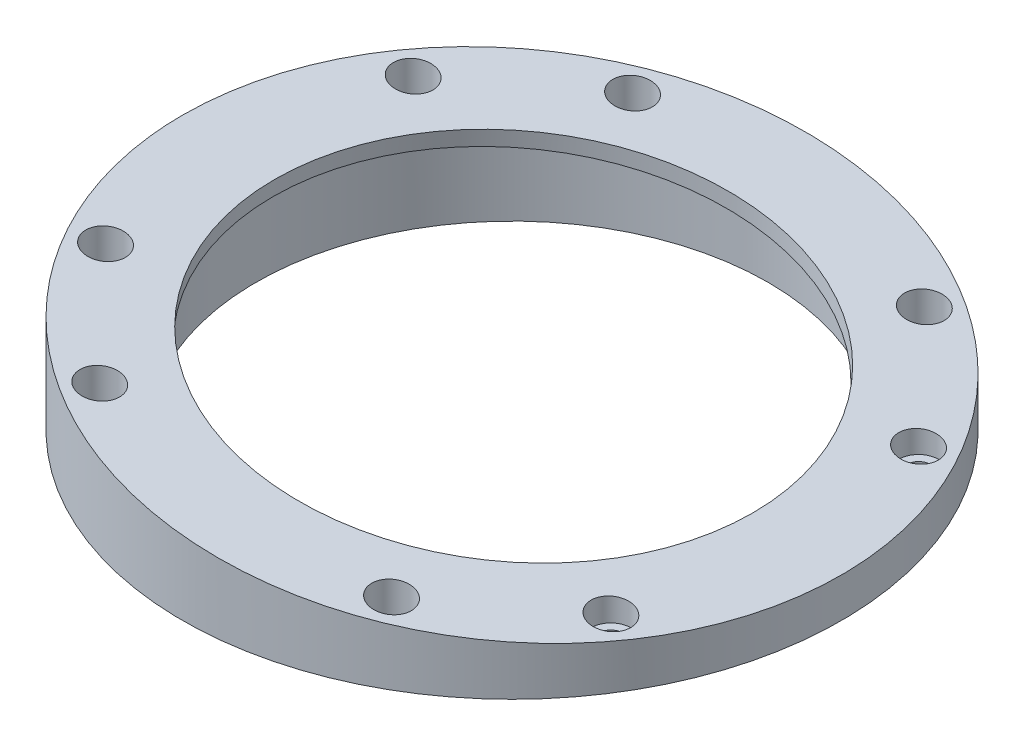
SolidWorks part; units mm, degrees
ref_plane "Front Plane" through (0, 0, 0) normal (0, 0, 1) x (1, 0, 0)
ref_plane "Top Plane" through (0, 0, 0) normal (0, 1, 0) x (1, 0, 0)
ref_plane "Right Plane" through (0, 0, 0) normal (1, 0, 0) x (0, 0, -1)
sketch "Sketch1" plane through (0, 0, 0) normal (0, 0, 1) x (1, 0, 0)
  line L13 (0, 0) -> (254, 0)
  line L14 (0, 0) -> (0, 254)
  line L15 (0, 254) -> (254, 254)
  line L16 (254, 0) -> (254, 254)
  dimension "D1" = 254
  dimension "D2" = 254
extrude "Boss-Extrude1" add sketch "Sketch1" along normal blind 254
sketch "Sketch5" plane through (0, 254, 0) normal (0, 1, 0) x (1, 0, 0)
  line L1 (0, 0) -> (254, 0)
  line L2 (0, 0) -> (0, -254)
  line L3 (0, -254) -> (254, -254)
  line L4 (254, 0) -> (254, -254)
  circle A0 centre (127, -127) radius 66.167
  dimension "D1" = 132.334
extrude "Cut-Extrude2" cut sketch "Sketch5" against normal through all
ref_plane "Plane1" through (0, 0, 193.167) normal (0, 0, 1) x (1, 0, 0)
sketch "Sketch6" plane through (0, 254, 0) normal (0, 1, 0) x (1, 0, 0)
  circle A1 centre (127, -127) radius 42.418
  dimension "D1" = 84.836
extrude "Cut-Extrude3" cut sketch "Sketch6" against normal through all
sketch "Sketch7" plane through (0, 0, 193.167) normal (0, 0, 1) x (1, 0, 0)
  line L0 (60.833, 254) -> (193.167, 240.2079)
  line L1 (193.167, 0) -> (193.167, 254) construction
  line L5 (193.167, 240.2079) -> (60.833, 240.2079)
  line L6 (60.833, 254) -> (60.833, 0) construction
  line L7 (60.833, 254) -> (193.167, 254)
  line L8 (193.167, 254) -> (193.167, 240.2079)
extrude "Cut-Extrude4" cut sketch "Sketch7" against normal up to next contours L8 L7 L0
sketch "Sketch8" plane through (0, 0, 0) normal (0, -1, 0) x (1, 0, 0)
  circle A0 centre (127, 127) radius 66.167
  circle A1 centre (127, 127) radius 50.8
  dimension "D1" = 101.6
extrude "Cut-Extrude5" cut sketch "Sketch8" against normal blind 232.283
sketch "Sketch11" plane through (0, 0, 0) normal (0, -1, 0) x (1, 0, 0)
  circle A0 centre (127, 127) radius 47.625
  circle A1 centre (127, 127) radius 50.8
extrude "Cut-Extrude6" cut sketch "Sketch11" against normal offset from surface (243.9117 mm away) 3.175
sketch "Sketch13" plane through (0, 0, 0) normal (0, -1, 0) x (1, 0, 0)
  circle A0 centre (127, 127) radius 47.8448
extrude "Cut-Extrude7" cut sketch "Sketch13" against normal up to surface (243.9117 mm away)
hole_wizard "1/16 (0.0625) Clearance Dowel Hole1" positions "Sketch14" profile "Sketch15" hole size "1/16" standard "ANSI Inch"
sketch "Sketch14" plane through (0, 232.283, 0) normal (0, -1, 0) x (-1, 0, 0)
  point P4 (-85.5349, -166.329)
sketch "Sketch15" plane through (85.5349, 232.283, 166.329) normal (1, 0, 0) x (0, 0, -1)
  line L0 (0, 0) -> (0, 6.8269)
  line L1 (0, 6.8269) -> (0.7937, 6.35)
  line L2 (0.7937, 6.35) -> (0.7937, 0)
  line L5 (0.7937, 0) -> (0, 0)
  line L10 (0, 6.8269) -> (-0.7938, 6.35) construction
  line L11 (0, -6.35) -> (0, 107.95) construction
  dimension "Hole Dia." = 1.5875
  dimension "Hole Depth" = 6.35
  dimension "Drill Angle" = 118
hole_wizard "1/16 (0.0625) Press Dowel Hole1" positions "Sketch16" profile "Sketch17" hole size "1/16" standard "ANSI Inch"
sketch "Sketch16" plane through (0, 232.283, 0) normal (0, -1, 0) x (-1, 0, 0)
  point P0 (-168.4651, -87.671)
sketch "Sketch17" plane through (168.4651, 232.283, 87.671) normal (1, 0, 0) x (0, 0, -1)
  line L0 (0, 0) -> (0, 6.8269)
  line L1 (0, 6.8269) -> (0.7937, 6.35)
  line L2 (0.7937, 6.35) -> (0.7937, 0)
  line L5 (0.7937, 0) -> (0, 0)
  line L10 (0, 6.8269) -> (-0.7938, 6.35) construction
  line L11 (0, -6.35) -> (0, 107.95) construction
  dimension "Hole Dia." = 1.5875
  dimension "Hole Depth" = 6.35
  dimension "Drill Angle" = 118
hole_wizard "#4-40 Tapped Hole1" positions "Sketch18" profile "Sketch19" tap size "#4-40" standard "ANSI Inch"
sketch "Sketch18" plane through (0, 232.283, 0) normal (0, -1, 0) x (-1, 0, 0)
  point P0 (-67.2039, -125.4191)
  point P3 (-128.5809, -67.2039)
  point P6 (-186.7961, -128.5809)
  point P9 (-125.4191, -186.7961)
sketch "Sketch19" plane through (67.2039, 232.283, 125.4191) normal (1, 0, 0) x (0, 0, -1)
  line L0 (0, 0) -> (0, 7.0292)
  line L1 (0, 7.0292) -> (1.1303, 6.35)
  line L2 (1.1303, 6.35) -> (1.1303, 0.7779)
  line L3 (1.1303, 0.7779) -> (2.0574, 0)
  line L5 (2.0574, 0) -> (0, 0)
  line L6 (-1.1303, 0.7779) -> (-2.0574, 0) construction
  line L10 (0, 7.0292) -> (-1.1303, 6.35) construction
  line L11 (0, -6.35) -> (0, 107.95) construction
  dimension "Tap Drill Dia." = 2.2606
  dimension "Tap Drill Depth" = 6.35
  dimension "Near C'Sink Dia." = 4.1148
  dimension "Near C'Sink Angle" = 100
  dimension "Drill Angle" = 118
ref_plane "Plane2" through (0, 255.143, 0) normal (0, -1, 0) x (-1, 0, 0)
hole_wizard "#16 (0.177) Diameter Hole1" positions "Sketch28" profile "Sketch29" hole size "#16" standard "ANSI Inch"
sketch "Sketch28" plane through (0, 232.283, 0) normal (0, -1, 0) x (-1, 0, 0)
  point P0 (-158.4663, -75.6807)
  point P3 (-179.9103, -98.2894)
  point P6 (-178.3193, -158.4663)
  point P9 (-155.7106, -179.9103)
  point P12 (-95.5337, -178.3193)
  point P15 (-74.0897, -155.7106)
  point P18 (-75.6807, -95.5337)
  point P21 (-98.2894, -74.0897)
sketch "Sketch29" plane through (158.4663, 232.283, 75.6807) normal (1, 0, 0) x (0, 0, -1)
  line L0 (0, 0) -> (0, 21.717)
  line L1 (0, 21.717) -> (2.2479, 21.717)
  line L2 (2.2479, 21.717) -> (2.2479, 0)
  line L5 (2.2479, 0) -> (0, 0)
  line L11 (0, -6.35) -> (0, 107.95) construction
  dimension "Thru Hole Dia." = 4.4958
  dimension "Thru Hole Depth" = 21.717
sketch "Sketch36" plane through (0, 255.143, 0) normal (0, -1, 0) x (-1, 0, 0)
  circle A1 centre (-75.6807, -95.5337) radius 3.9687
  circle A2 centre (-98.2894, -74.0897) radius 3.9687
  circle A3 centre (-158.4663, -75.6807) radius 3.9687
  circle A4 centre (-179.9103, -98.2894) radius 3.9687
  circle A5 centre (-178.3193, -158.4663) radius 3.9687
  circle A6 centre (-155.7106, -179.9103) radius 3.9687
  circle A7 centre (-95.5337, -178.3193) radius 3.9687
  circle A8 centre (-74.0897, -155.7106) radius 3.9687
  dimension "D1" = 7.9375
  dimension "D2" = 7.9375
  dimension "D3" = 7.9375
  dimension "D4" = 7.9375
  dimension "D5" = 7.9375
  dimension "D6" = 7.9375
  dimension "D7" = 7.9375
  dimension "D8" = 7.9375
extrude "Cut-Extrude8" cut sketch "Sketch36" along normal offset from surface (17.78 mm away) 5.08
sketch "Sketch37" plane through (0, 232.283, 0) normal (0, -1, 0) x (1, 0, 0)
  circle A0 centre (127, 127) radius 51.435
  dimension "D1" = 102.87
extrude "Cut-Extrude9" cut sketch "Sketch37" against normal up to surface (11.6287 mm away)
sketch "Sketch38" plane through (26.5125, 254.3848, 0) normal (-0.1037, -0.9946, 0) x (0.9946, -0.1037, 0)
  circle A0 centre (101.0318, 127) radius 48.26
  dimension "D1" = 96.52
extrude "Cut-Extrude10" cut sketch "Sketch38" against normal through all
